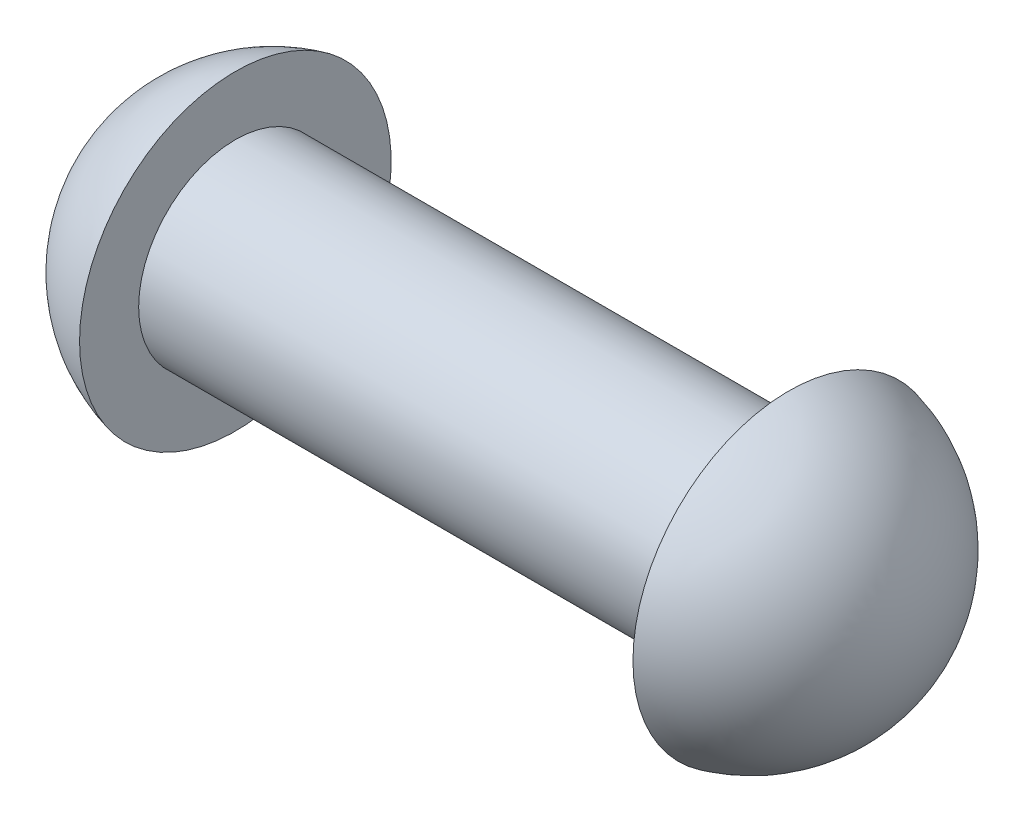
SolidWorks part; units mm, degrees
ref_plane "Plane1" through (0, 0, 0) normal (0, 0, 1) x (1, 0, 0)
ref_plane "Plane2" through (0, 0, 0) normal (0, 1, 0) x (1, 0, 0)
ref_plane "Plane3" through (0, 0, 0) normal (1, 0, 0) x (0, 0, -1)
sketch "Sketch1" plane through (0, 0, 0) normal (0, 0, 1) x (1, 0, 0)
  line L0 (-138, 0) -> (13, 0) construction
  line L1 (-126, 0) -> (0, 0)
  line L2 (-103, 18) -> (-103, 29)
  line L3 (-103, 18) -> (0, 18)
  line L4 (0, 18) -> (0, 0)
  arc A0 (-103, 29) -> (-126, 0) centre (-96.0005, -0.172) ccw
  point P12 (-103, 18)
  dimension "HeadRadius" = 30
  dimension "Diameter" = 36
  dimension "GripLength" = 103
  dimension "HeadHt" = 23
  dimension "HeadDia" = 58
revolve "Base-Revolve" add sketch "Sketch1" angle 360 about L0
sketch "Sketch2" plane through (0, 0, 0) normal (0, 0, 1) x (1, 0, 0)
  line L0 (-49, 0) -> (71, 0) construction
  line L1 (0, 0) -> (23, 0)
  line L2 (0, 0) -> (0, 29)
  arc A0 (23, 0) -> (0, 29) centre (-6.9995, -0.172) ccw
  dimension "D1" = 58
  dimension "D3" = 30
  dimension "D2" = 23
revolve "HeadTypeA" add sketch "Sketch2" angle 360 about L0
sketch "Sketch3" plane through (0, 0, 0) normal (0, 0, 1) x (1, 0, 0)
  line L0 (6, 0) -> (-54, 0) construction
  line L1 (-138, 0) -> (13, 0) construction
  line L2 (0, 0) -> (0, 26)
  line L3 (0, 26) -> (-19.3137, 18)
  line L4 (0, -26) -> (-19.3137, -18) construction
  line L6 (-19.3137, 0) -> (-19.3137, 18)
  line L7 (-19.3137, 0) -> (0, 0)
  dimension "D1" = 36
  dimension "HeadDia" = 52
  dimension "HeadAng" = 45
revolve "HeadTypeB" [suppressed] add sketch "Sketch3" angle 360 about L0
equation "\"D1@Sketch2\" = \"HeadDia@Sketch1\""
equation "\"D2@Sketch2\" = \"HeadHt@Sketch1\""
equation "\"D3@Sketch2\" = \"HeadRadius@Sketch1\""
equation "\"D1@Sketch3\" = \"Diameter@Sketch1\""
